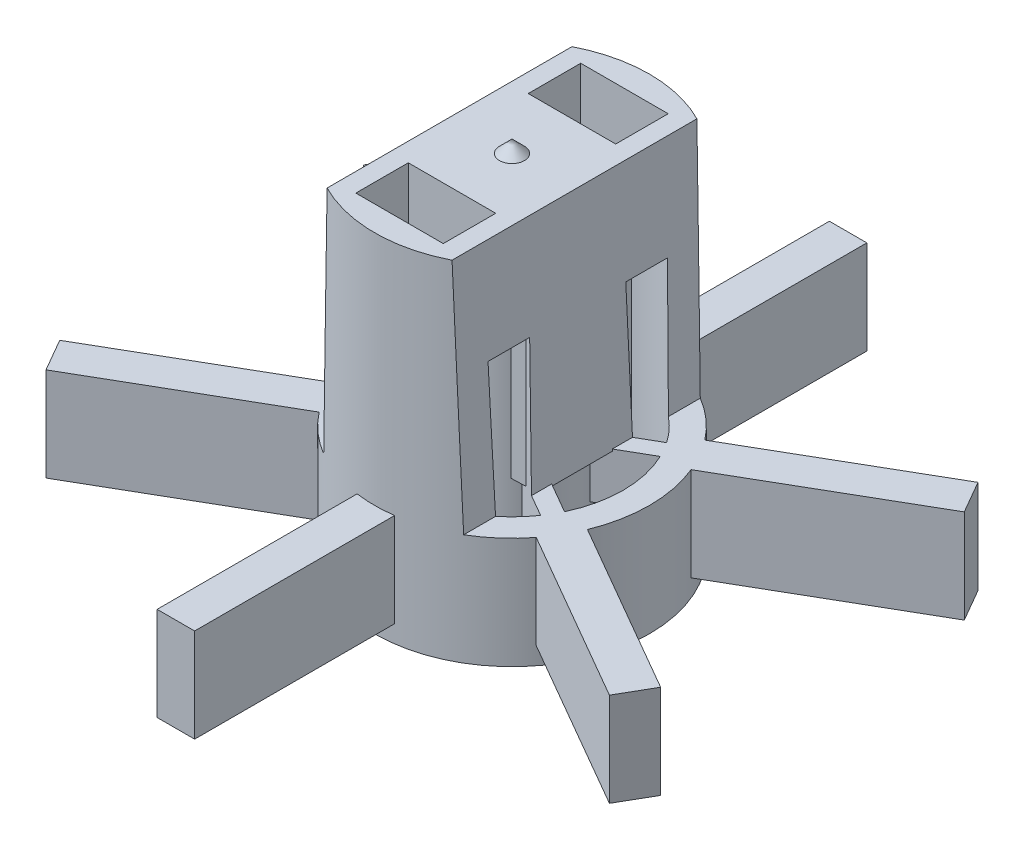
SolidWorks part; units mm, degrees
ref_plane "Plan de face" through (0, 0, 0) normal (0, 0, 1) x (1, 0, 0)
ref_plane "Plan de dessus" through (0, 0, 0) normal (0, 1, 0) x (1, 0, 0)
ref_plane "Plan de droite" through (0, 0, 0) normal (1, 0, 0) x (0, 0, -1)
sketch "Esquisse1" plane through (0, 0, 0) normal (0, 0, 1) x (1, 0, 0)
  line L0 (0, 0) -> (0, 49.153) construction
  line L1 (1.55, 2.5) -> (1.55, 14.3)
  line L2 (1.55, 14.3) -> (0, 15.85)
  line L3 (0, 15.85) -> (0, 16.9)
  line L4 (0, 16.9) -> (0.5, 16.4)
  line L5 (0.5, 16.4) -> (5.5, 16.4)
  line L6 (5.5, 16.4) -> (5.5, 2.5)
  line L7 (2.4, 12.3) -> (4.45, 12.3)
  line L8 (4.45, 12.3) -> (4.45, 2.5)
  line L9 (2.4, 12.3) -> (2.4, 2.5)
  line L10 (2.4, 2.5) -> (1.55, 2.5)
  line L11 (4.45, 2.5) -> (5.5, 2.5)
  dimension "D1" = 3.1
  dimension "D2" = 13.9
  dimension "D3" = 0.5
  dimension "D4" = 135
  dimension "D5" = 135
  dimension "D6" = 11
  dimension "D7" = 8.9
  dimension "D8" = 4.8
  dimension "D9" = 9.8
  dimension "D10" = 13.9
  dimension "D11" = 2.5
  dimension "D12" = 11.8
revolve "Révolution1" add sketch "Esquisse1" angle 360 about L0
sketch "Esquisse3" plane through (0, 12.3, 0) normal (0, -1, 0) x (1, 0, 0)
  line L1 (0.35, 4.75) -> (-0.35, 4.75)
  line L2 (0.35, 4.75) -> (0.35, 2)
  line L3 (0.35, 2) -> (-0.35, 2)
  line L4 (-0.35, 4.75) -> (-0.35, 2)
  dimension "D1" = 0.35
  dimension "D2" = 0.7
  dimension "D3" = 2
  dimension "D4" = 2.75
extrude "Extrusion1" add sketch "Esquisse3" along normal blind 7.3
pattern_circular "Répétition circulaire1" count 6 over 360 about axis through (0, 0, 0) along (0, 1, 0) of "Extrusion1"
sketch "Esquisse2" plane through (0, 0, 0) normal (0, 0, 1) x (1, 0, 0)
  line L0 (2.5, 16.4) -> (2.8, 6.95)
  line L1 (2.8, 6.95) -> (7.3648, 6.95)
  line L2 (7.3648, 6.95) -> (7.3648, 16.4)
  line L3 (7.3648, 16.4) -> (2.5, 16.4)
  line L4 (0, 16.9) -> (0, 14.3922) construction
  line L5 (5.5, 16.4) -> (-5.5, 16.4) construction
  line L6 (-5.5, 2.5) -> (5.5, 2.5) construction
  line L7 (-7.3648, 16.4) -> (-2.5, 16.4)
  line L8 (-7.3648, 6.95) -> (-7.3648, 16.4)
  line L9 (-2.8, 6.95) -> (-7.3648, 6.95)
  line L10 (-2.5, 16.4) -> (-2.8, 6.95)
  dimension "D1" = 2.5
  dimension "D2" = 2.8
  dimension "D3" = 4.45
extrude "Enlèv. mat.-Extru.1" cut sketch "Esquisse2" against normal mid plane 20
sketch "Esquisse4" plane through (3.0176, 0.0958, 0) normal (0.9995, 0.0317, 0) x (0, 0, -1)
  line L1 (-1.7154, 6.7807) -> (1.6779, 6.7807)
  line L2 (-1.7154, 6.7807) -> (-1.7154, 12.585)
  line L3 (-1.7154, 12.585) -> (1.6779, 12.585)
  line L4 (1.6779, 6.7807) -> (1.6779, 12.585)
  ellipse E0 centre (0, 6.9465) end of major axis (5.5, 6.9465) minor radius 0.1745 (-4.7339, 6.8577) -> (4.7339, 6.8577) ccw construction
extrude "Extrusion2" add sketch "Esquisse4" against normal up to surface (1.1245 mm away)
mirror "Symétrie1" about plane through (0, 0, 0) normal (1, 0, 0) of "Extrusion2"
sketch "Esquisse5" plane through (0, 16.4, 0) normal (0, 1, 0) x (-1, 0, 0)
  line L0 (0, 0) -> (-1.75, 0) construction
  line L1 (-1.75, -4.5) -> (1.75, -4.5)
  line L2 (-1.75, -4.5) -> (-1.75, -2.4)
  line L3 (-1.75, -2.4) -> (1.75, -2.4)
  line L4 (1.75, -4.5) -> (1.75, -2.4)
  line L5 (1.75, 4.5) -> (1.75, 2.4)
  line L6 (-1.75, 2.4) -> (1.75, 2.4)
  line L7 (-1.75, 4.5) -> (-1.75, 2.4)
  line L8 (-1.75, 4.5) -> (1.75, 4.5)
  dimension "D1" = 4.5
  dimension "D2" = 3.5
  dimension "D3" = 1.75
  dimension "D4" = 2.1
extrude "Enlèv. mat.-Extru.2" cut sketch "Esquisse5" against normal blind 3.75
sketch "Esquisse6" plane through (0, 6.95, 0) normal (0, 1, 0) x (-1, 0, 0)
  line L0 (-11.273, 7.3745) -> (-4.0449, 3.2014)
  line L1 (-4.0449, 3.2014) -> (-4.6838, 1.8382)
  line L2 (-4.6838, 1.8382) -> (-12.023, 6.0755)
  line L3 (-12.023, 6.0755) -> (-11.273, 7.3745)
  line L4 (-3.6669, 2.5212) -> (-2.8, 2.0207) construction
  line L5 (-2.8, 1.2124) -> (-4.0169, 1.915) construction
  dimension "D1" = 1.5
  dimension "D2" = 0.75
  dimension "D3" = 13.45
extrude "Extrusion3" add sketch "Esquisse6" against normal blind 3.75
pattern_circular "Répétition circulaire2" count 6 over 360 about axis through (0, 0, 0) along (0, 1, 0) of "Extrusion3"
